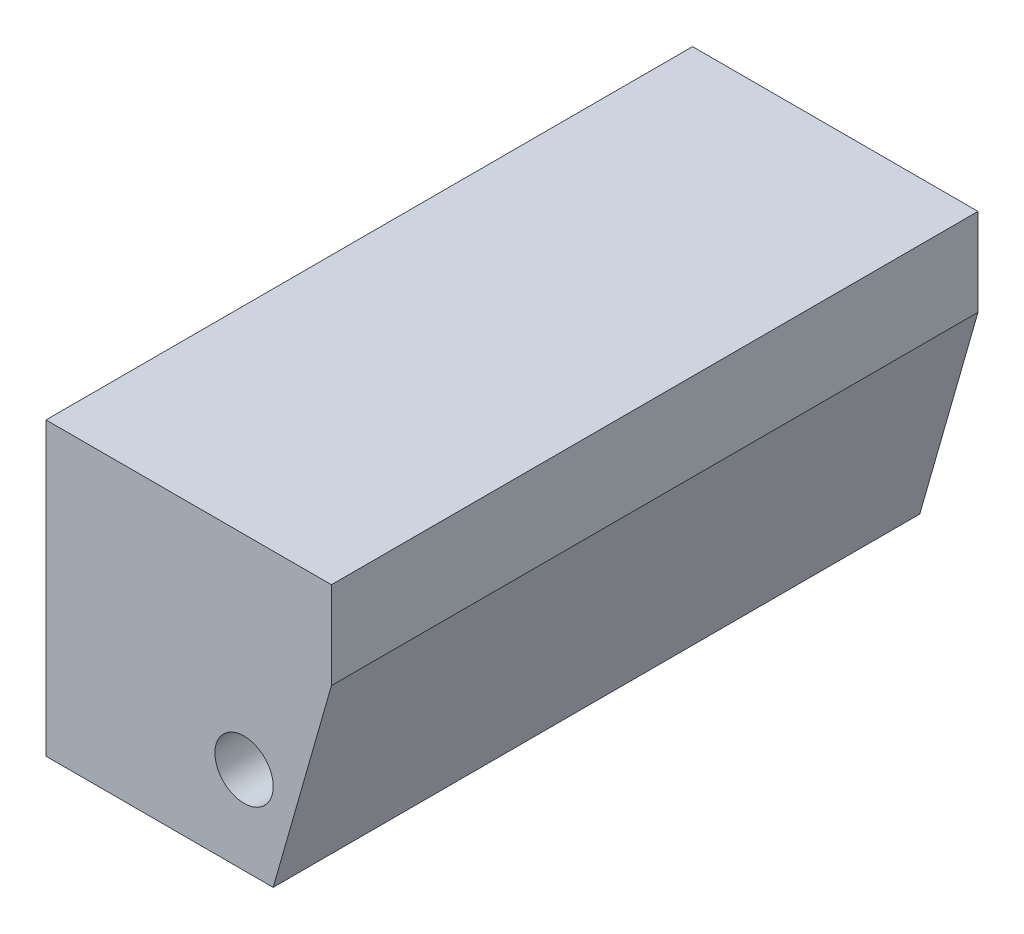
SolidWorks part; units mm, degrees
ref_plane "Piano frontale" through (0, 0, 0) normal (0, 0, 1) x (1, 0, 0)
ref_plane "Piano superiore" through (0, 0, 0) normal (0, 1, 0) x (1, 0, 0)
ref_plane "Piano destro" through (0, 0, 0) normal (1, 0, 0) x (0, 0, -1)
sketch "Schizzo1" plane through (0, 0, 0) normal (0, 1, 0) x (1, 0, 0)
  line L1 (0, 0) -> (49, 0)
  line L2 (0, 0) -> (0, 111)
  line L3 (0, 111) -> (49, 111)
  line L4 (49, 0) -> (49, 111)
  dimension "D1" = 111
  dimension "D2" = 49
extrude "Estrusione-Estrusione1" add sketch "Schizzo1" along normal blind 50
sketch "Schizzo2" plane through (0, 0, 0) normal (0, 0, 1) x (1, 0, 0)
  line L0 (49, 35) -> (39, 0)
  line L1 (49, 50) -> (49, 0) construction
  line L2 (0, 0) -> (49, 0) construction
  line L3 (39, 0) -> (49, 0)
  line L4 (49, 0) -> (49, 35)
  dimension "D1" = 15
  dimension "D2" = 10
extrude "Taglio-Estrusione1" cut sketch "Schizzo2" against normal blind 125.5
sketch "Schizzo3" plane through (0, 0, 0) normal (0, 0, 1) x (1, 0, 0)
  line L0 (49, 50) -> (49, 35) construction
  line L1 (0, 0) -> (39, 0) construction
  circle A0 centre (34, 15) radius 5.005
  dimension "D3" = 10.01
  dimension "D1" = 15
  dimension "D2" = 15
extrude "Taglio-Estrusione2" cut sketch "Schizzo3" against normal blind 125.5
